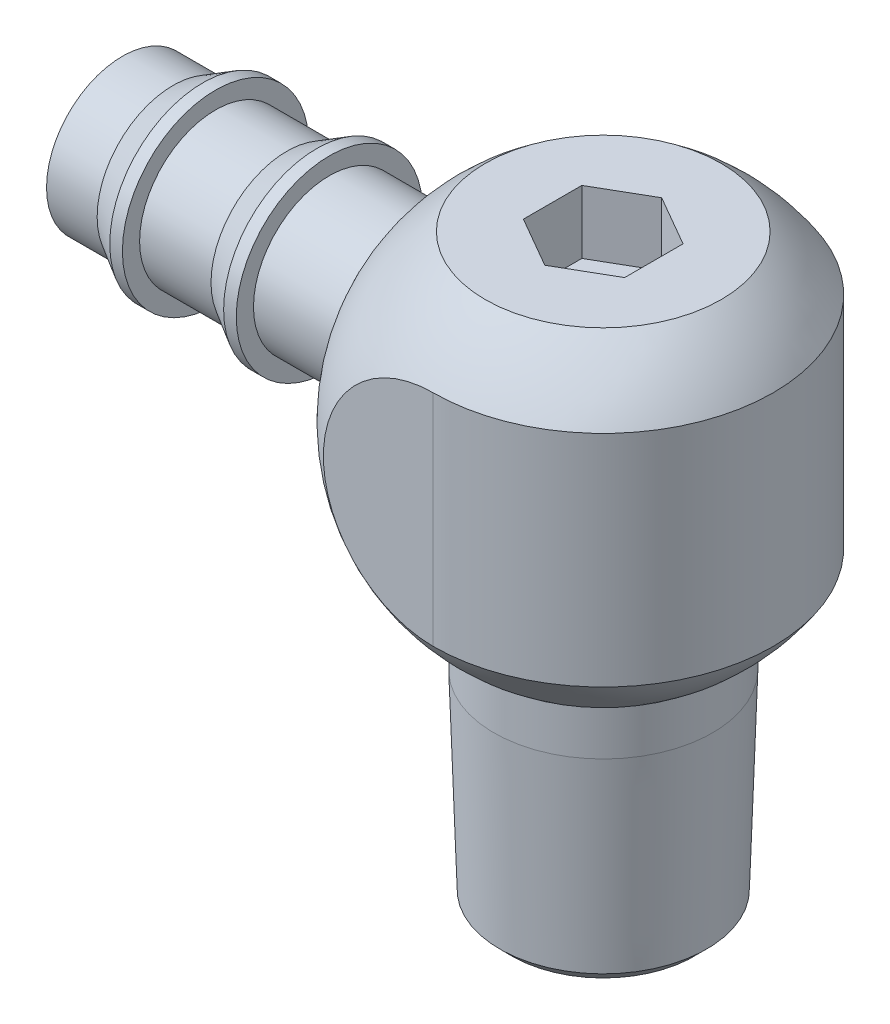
SolidWorks part; units mm, degrees
ref_plane "Front Plane" through (0, 0, 0) normal (0, 0, 1) x (1, 0, 0)
ref_plane "Top Plane" through (0, 0, 0) normal (0, 1, 0) x (1, 0, 0)
ref_plane "Right Plane" through (0, 0, 0) normal (1, 0, 0) x (0, 0, -1)
ref_plane "Plane1" through (0, 15.9829, 0) normal (0, 1, 0) x (-1, 0, 0)
sketch "Sketch1" plane through (0, 0, 0) normal (0, 0, 1) x (1, 0, 0)
  line L0 (0, 0) -> (0, 50000) construction
  line L1 (0, 28.6829) -> (0, 3.2829)
  line L2 (55, 15.9829) -> (-55, 15.9829) construction
  arc A1 (0, 3.2829) -> (0, 28.6829) centre (0, 15.9829) ccw
  dimension "D1" = 25.4
revolve "Revolve1" add sketch "Sketch1" angle 360 about L0
sketch "Sketch3" plane through (0, 0, 0) normal (0, 1, 0) x (1, 0, 0)
  line L0 (2.5806, 0) -> (50002.5806, 0) construction
  line L1 (0, -10.668) -> (-10.668, -10.668)
  line L2 (-10.668, -10.668) -> (-10.668, 10.668)
  line L3 (0, 10.668) -> (-10.668, 10.668)
  circle A0 centre (0, 0) radius 10.668 construction
  arc A1 (0, -10.668) -> (0, 10.668) centre (0, 0) ccw
  point P12 (-10.668, 0)
  dimension "D1" = 21.336
extrude "Cut-Extrude1" cut sketch "Sketch3" against normal through all and the other way through all flip side to cut
sketch "Sketch4" plane through (0, 0, 0) normal (0, 0, 1) x (1, 0, 0)
  line L0 (0, 0) -> (0, 50000) construction
  line L1 (-19.05, 26.3017) -> (19.05, 26.3017)
  line L2 (-19.05, 26.3017) -> (-19.05, 5.6642)
  line L3 (-19.05, 5.6642) -> (19.05, 5.6642)
  line L4 (19.05, 26.3017) -> (19.05, 5.6642)
  line L5 (0, 9.0921) -> (0, 22.8738) construction
  line L6 (0, 15.9829) -> (50000, 15.9829) construction
  line L7 (11.7348, 15.9829) -> (-11.7348, 15.9829) construction
  point P8 (0, 15.9829)
  dimension "D1" = 20.6375
  dimension "D2" = 38.1
extrude "Cut-Extrude2" cut sketch "Sketch4" against normal through all and the other way through all flip side to cut
sketch "Sketch9" plane through (0, 15.9829, 0) normal (0, 1, 0) x (1, 0, 0)
  line L0 (0, 0) -> (50000, 0) construction
  line L1 (-30.1625, 0) -> (-30.1625, 4.7625)
  line L2 (-30.1625, 4.7625) -> (-26.9875, 4.7625)
  line L3 (-26.9875, 4.7625) -> (-25.1178, 5.842)
  line L4 (-25.1178, 5.842) -> (-24.324, 5.842)
  line L5 (-24.324, 5.842) -> (-24.324, 4.7625)
  line L6 (-24.324, 4.7625) -> (-19.8438, 4.7625)
  line L7 (-19.8438, 4.7625) -> (-17.974, 5.842)
  line L8 (-17.974, 5.842) -> (-17.1803, 5.842)
  line L9 (-17.1803, 5.842) -> (-17.1803, 4.7625)
  line L10 (-17.1803, 4.7625) -> (0, 4.7625)
  line L11 (0, 4.7625) -> (0, 0)
  line L12 (-30.1625, 0) -> (0, 0)
  line L13 (0, 0) -> (0, 50000) construction
  dimension "D1" = 9.525
  dimension "D2" = 1.0795
  dimension "D4" = 19.8438
  dimension "D5" = 3.175
  dimension "D6" = 30.1625
  dimension "D7" = 0.7937
  dimension "D8" = 30
revolve "Revolve2" add sketch "Sketch9" angle 360 about L0
fillet "Fillet1" radius 1.1906 1 edges at (-10.668, 15.9829, -4.7625)
sketch "Sketch10" plane through (-30.1625, 0, 0) normal (-1, 0, 0) x (0, 0, 1)
  circle A0 centre (0, 15.9829) radius 3.4925
  circle A1 centre (0, 15.9829) radius 4.7625 construction
  dimension "D1" = 1.27
extrude "Cut-Extrude3" cut sketch "Sketch10" against normal up to surface (30.1625 mm away)
sketch "Sketch11" plane through (0, 0, 0) normal (0, 0, 1) x (1, 0, 0)
  line L2 (-7.4036, 5.6642) -> (7.4036, 5.6642) construction
  line L5 (6.4849, -9.4488) -> (6.858, 2.4892)
  line L6 (6.858, 2.4892) -> (6.858, 5.6642)
  line L7 (0, 5.6642) -> (6.858, 5.6642)
  line L8 (0, -10.2108) -> (5.7229, -10.2108)
  line L9 (5.7229, -10.2108) -> (6.4849, -9.4488)
  line L10 (0, -11.0196) -> (0, -50011.0196) construction
  line L11 (0, -10.2108) -> (0, 5.6642)
  dimension "D1" = 3.175
  dimension "D2" = 13.716
  dimension "D3" = 15.875
  dimension "D4" = 1.79
  dimension "D5" = 45
  dimension "D6" = 0.762
revolve "Revolve3" add sketch "Sketch11" angle 360 about L10
sketch "Sketch12" plane through (0, 26.3017, 0) normal (0, 1, 0) x (1, 0, 0)
  line L0 (0, 3.4925) -> (0, -3.4925) construction
  line L1 (3.175, 1.8331) -> (0, 3.6662)
  line L2 (0, 3.6662) -> (-3.175, 1.8331)
  line L3 (-3.175, 1.8331) -> (-3.175, -1.8331)
  line L4 (-3.175, -1.8331) -> (0, -3.6662)
  line L5 (0, -3.6662) -> (3.175, -1.8331)
  line L6 (3.175, -1.8331) -> (3.175, 1.8331)
  line L7 (0, -11.7348) -> (0, 11.7348) construction
  circle A0 centre (0, 0) radius 3.175 construction
  dimension "D1" = 6.35
extrude "Cut-Extrude4" cut sketch "Sketch12" against normal blind 3.9688
sketch "Sketch13" plane through (0, -10.2108, 0) normal (0, -1, 0) x (1, 0, 0)
  circle A1 centre (0, 0) radius 4.7625
  circle A2 centre (0, 0) radius 6.858 construction
  dimension "D1" = 9.525
extrude "Cut-Extrude5" cut sketch "Sketch13" against normal blind 29.6875
